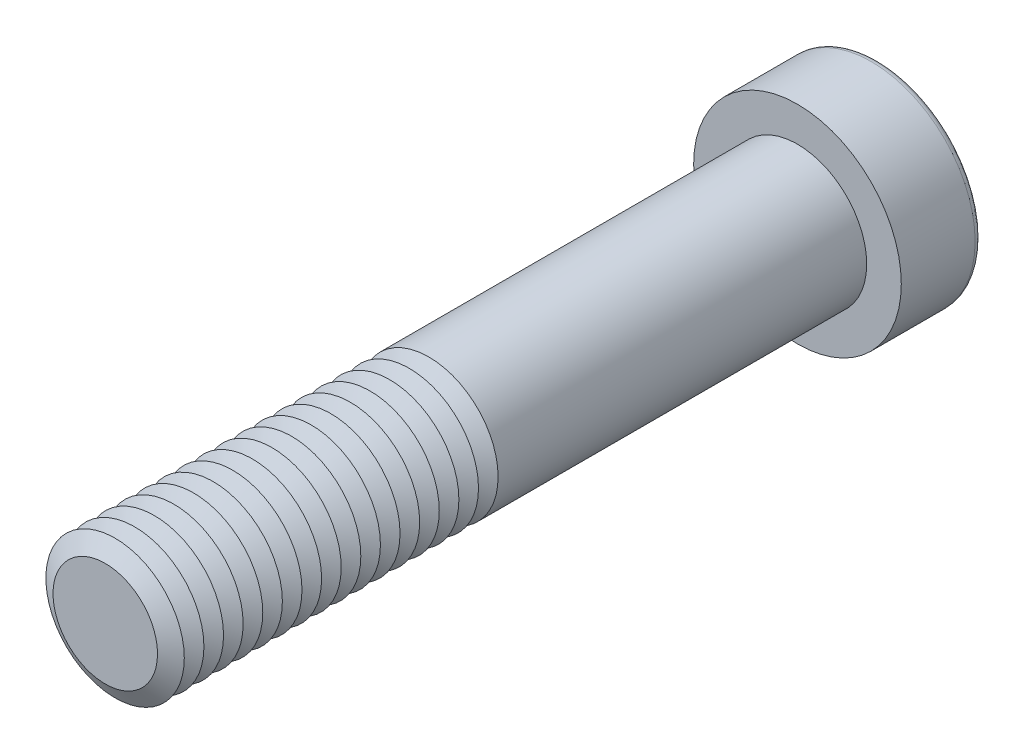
SolidWorks part; units mm, degrees
ref_plane "Front Plane" through (0, 0, 0) normal (0, 0, 1) x (1, 0, 0)
ref_plane "Top Plane" through (0, 0, 0) normal (0, 1, 0) x (1, 0, 0)
ref_plane "Right Plane" through (0, 0, 0) normal (1, 0, 0) x (0, 0, -1)
sketch "Sketch1" plane through (0, 0, 0) normal (0, 0, 1) x (1, 0, 0)
  circle A0 centre (0, 0) radius 6
  dimension "D1" = 12
extrude "Boss-Extrude1" add sketch "Sketch1" along normal blind 60
sketch "Sketch2" plane through (0, 0, 0) normal (0, 0, -1) x (-1, 0, 0)
  circle A0 centre (0, 0) radius 9
  dimension "D1" = 18
extrude "Boss-Extrude2" add sketch "Sketch2" along normal blind 7
sketch "Sketch3" plane through (0, 0, -7) normal (0, 0, -1) x (-1, 0, 0)
  line L1 (-2.3094, 4) -> (-4.6188, 0)
  line L2 (-4.6188, 0) -> (-2.3094, -4)
  line L3 (-2.3094, -4) -> (2.3094, -4)
  line L4 (2.3094, -4) -> (4.6188, 0)
  line L5 (4.6188, 0) -> (2.3094, 4)
  line L6 (2.3094, 4) -> (-2.3094, 4)
  circle A0 centre (0, 0) radius 4 construction
  dimension "D1" = 8
extrude "Cut-Extrude1" cut sketch "Sketch3" against normal blind 6
fillet "Fillet1" radius 0.6 1 edges at (-9, 0, -7)
sketch "Sketch4" plane through (0, 0, -1) normal (0, 0, -1) x (-1, 0, 0)
  line L0 (2.3094, -4) -> (4.6188, 0) construction
  circle A0 centre (0, 0) radius 4
extrude "Cut-Extrude2" cut sketch "Sketch4" against normal through all draft 60
sketch "Sketch5" plane through (0, 0, -7) normal (0, 0, -1) x (-1, 0, 0)
  circle A0 centre (0, 0) radius 4.6188
extrude "Cut-Extrude3" cut sketch "Sketch5" against normal through all draft 75
sketch "Sketch7" plane through (0, 0, 0) normal (1, 0, 0) x (0, 0, -1)
  line L25 (-60, 4.5278) -> (-59.15, 6)
  line L26 (-60, 6) -> (-60, -6) construction
  line L27 (-59.15, 6) -> (-60.85, 6)
  line L28 (-60.85, 6) -> (-60, 4.5278)
  line L29 (0, 6) -> (-60, 6) construction
  dimension "D1" = 1.7
revolve "Cut-Revolve1" cut sketch "Sketch7" angle 360 about axis through (0, 0, 60) along (0, 0, -1)
pattern_linear "LPattern1" count 17 spacing 1.7 along (0, 0, -1) of "Cut-Revolve1"
